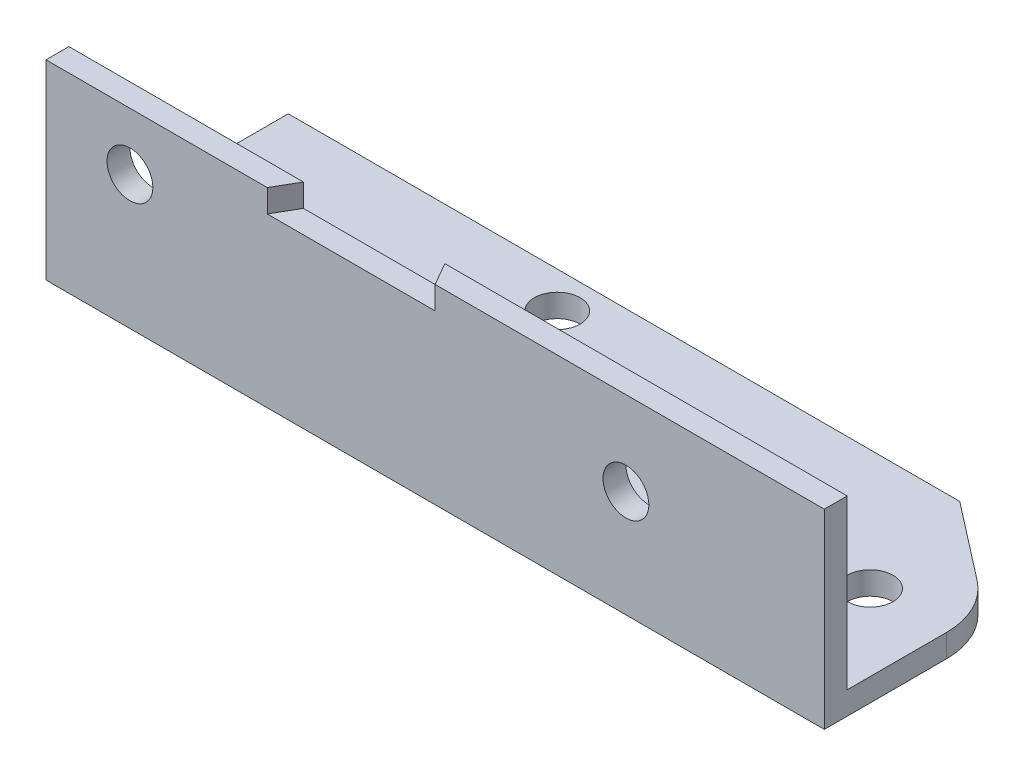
SolidWorks part; units mm, degrees
ref_plane "Front" through (0, 0, 0) normal (0, 0, 1) x (1, 0, 0)
ref_plane "Top" through (0, 0, 0) normal (0, 1, 0) x (1, 0, 0)
ref_plane "Right" through (0, 0, 0) normal (1, 0, 0) x (0, 0, -1)
sketch "Sketch1" plane through (0, 0, 0) normal (0, 1, 0) x (1, 0, 0)
  line L1 (0, 0) -> (102, 0)
  line L2 (0, 0) -> (0, 31.75)
  line L3 (0, 31.75) -> (88, 31.75)
  line L4 (102, 0) -> (102, 16)
  line L6 (88, 31.75) -> (98.1249, 23.9047)
  circle A0 centre (40, 27) radius 3
  circle A1 centre (92, 16) radius 3
  arc A2 (102, 16) -> (98.1249, 23.9047) centre (92, 16) ccw
  dimension "D1" = 31.75
  dimension "D2" = 6
  dimension "D3" = 6
  dimension "D4" = 10
  dimension "D5" = 27
  dimension "D6" = 16
  dimension "D8" = 10
  dimension "D9" = 92
  dimension "D10" = 40
  dimension "D7" = 14
extrude "Extrude1" add sketch "Sketch1" along normal blind 3
sketch "Sketch2" plane through (0, 3, 0) normal (0, 1, 0) x (-1, 0, 0)
  line L0 (-102, 0) -> (-102, -16) construction
  line L1 (0, 0) -> (-102, 0)
  line L2 (0, 0) -> (0, -3)
  line L3 (0, -3) -> (-102, -3)
  line L4 (-102, 0) -> (-102, -3)
extrude "Extrude2" add sketch "Sketch2" along normal blind 22
sketch "Sketch3" plane through (0, 0, -3) normal (0, 0, -1) x (-1, 0, 0)
  line L0 (-102, 25) -> (0, 25) construction
  line L1 (0, 25) -> (0, 3) construction
  circle A0 centre (-11, 17.5) radius 3
  dimension "D1" = 7.5
  dimension "D2" = 6
  dimension "D3" = 11
extrude "Cut-Extrude1" cut sketch "Sketch3" against normal through all
sketch "Sketch4" plane through (0, 25, 0) normal (0, 1, 0) x (-1, 0, 0)
  line L0 (-29, 0) -> (-33.6188, -8)
  line L1 (-51, 0) -> (-46.3812, -8)
  line L5 (-33.6188, -8) -> (-46.3812, -8)
  line L6 (-29, 0) -> (-51, 0)
  dimension "D1" = 29
  dimension "D2" = 22
  dimension "D3" = 60
  dimension "D4" = 60
  dimension "D5" = 8
extrude "Cut-Extrude2" cut sketch "Sketch4" against normal blind 3
sketch "Sketch5" plane through (0, 0, -3) normal (0, 0, -1) x (-1, 0, 0)
  line L0 (-102, 25) -> (-49.2679, 25) construction
  line L1 (-102, 25) -> (-102, 3) construction
  circle A0 centre (-76, 14) radius 3
  dimension "D1" = 11
  dimension "D2" = 26
  dimension "D3" = 6
extrude "Cut-Extrude3" cut sketch "Sketch5" against normal through all
